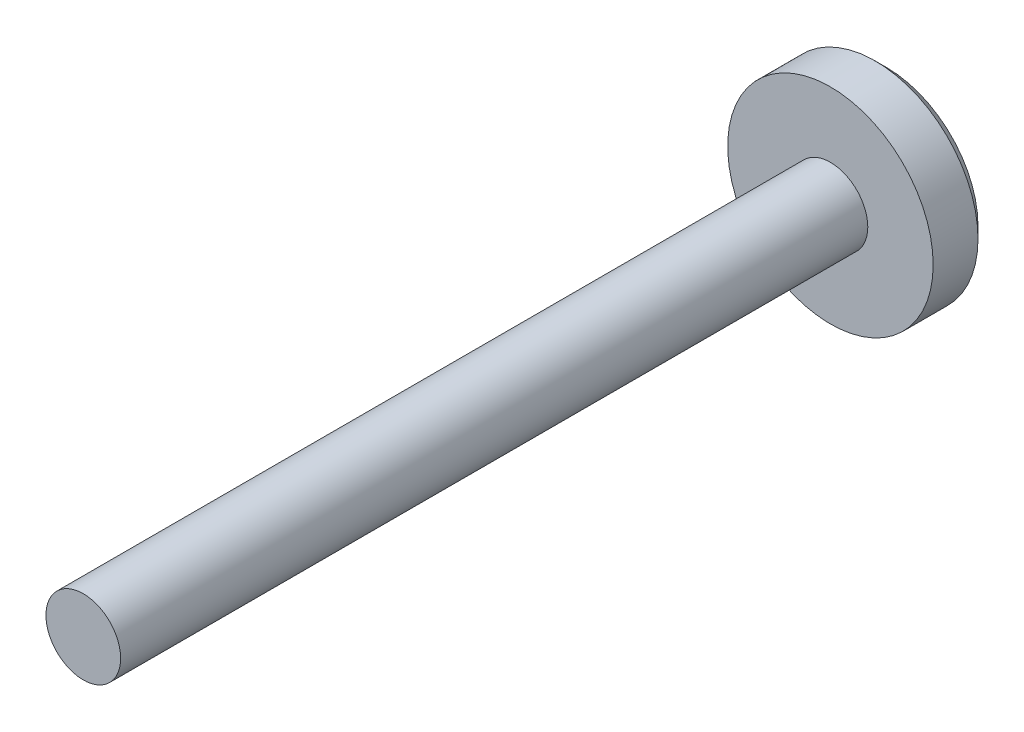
SolidWorks part; units mm, degrees
ref_plane "Face" through (0, 0, 0) normal (0, 0, 1) x (1, 0, 0)
ref_plane "Dessus" through (0, 0, 0) normal (0, 1, 0) x (1, 0, 0)
ref_plane "Droite" through (0, 0, 0) normal (1, 0, 0) x (0, 0, -1)
sketch "Esquisse1" plane through (0, 0, 0) normal (0, 0, 1) x (1, 0, 0)
  circle A0 centre (0, 0) radius 27.5
  dimension "D1" = 55
extrude "Base-Extrusion" add sketch "Esquisse1" along normal blind 15
sketch "Esquisse2" plane through (0, 0, 15) normal (0, 0, 1) x (1, 0, 0)
  circle A0 centre (0, 0) radius 10
  circle A1 centre (0, 0) radius 27.5 construction
  dimension "D1" = 20
extrude "Boss.-Extru.1" add sketch "Esquisse2" along normal blind 200
chamfer "Chanfrein1" distance 3 angle 45
